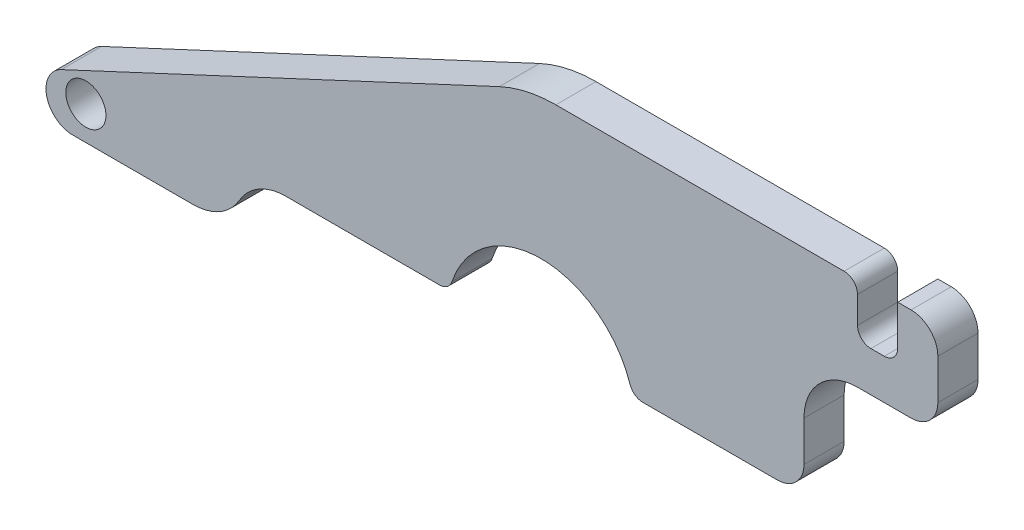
SolidWorks part; units mm, degrees
ref_plane "Front Plane" through (0, 0, 0) normal (0, 0, 1) x (1, 0, 0)
ref_plane "Top Plane" through (0, 0, 0) normal (0, 1, 0) x (1, 0, 0)
ref_plane "Right Plane" through (0, 0, 0) normal (1, 0, 0) x (0, 0, -1)
sketch "Sketch1" plane through (0, 0, 0) normal (0, 0, 1) x (1, 0, 0)
  line L0 (-25.9119, 5.4688) -> (-9.5595, 13.094)
  line L1 (-7.4465, 13.5625) -> (3.3201, 13.5625)
  line L2 (3.8201, 13.0625) -> (3.8201, 12.0625)
  line L3 (4.3201, 11.5625) -> (4.8201, 11.5625)
  line L4 (5.3201, 12.0625) -> (5.3201, 13.5625)
  line L5 (5.3201, 13.5625) -> (5.8201, 13.5625)
  line L6 (6.8201, 12.5625) -> (6.8201, 11.0625)
  line L7 (5.8201, 10.0625) -> (4.0076, 10.0625)
  line L8 (4.0076, 10.0625) -> (3.8201, 10.0625)
  line L9 (1.8201, 8.0625) -> (1.8201, 6.5625)
  line L10 (0.8201, 5.5625) -> (-4.2003, 5.5625)
  line L12 (-25.4893, 3.5625) -> (-21, 3.5625)
  line L13 (-30.1051, 5.5625) -> (3.2401, 5.5625) construction
  line L14 (-11.7997, 5.5625) -> (-17.5359, 5.5625)
  arc A0 (-11.3247, 5.9063) -> (-4.6753, 5.9063) centre (-8, 4.8125) cw
  circle A1 centre (-25, 4.8125) radius 0.75
  arc A2 (1.8201, 6.5625) -> (0.8201, 5.5625) centre (0.8201, 6.5625) cw
  arc A3 (6.8201, 11.0625) -> (5.8201, 10.0625) centre (5.8201, 11.0625) cw
  arc A4 (5.8201, 13.5625) -> (6.8201, 12.5625) centre (5.8201, 12.5625) cw
  arc A5 (-25.9119, 5.4688) -> (-25.4893, 3.5625) centre (-25.4893, 4.5625) ccw
  arc A8 (3.3201, 13.5625) -> (3.8201, 13.0625) centre (3.3201, 13.0625) cw
  arc A9 (4.8201, 11.5625) -> (5.3201, 12.0625) centre (4.8201, 12.0625) ccw
  arc A10 (3.8201, 12.0625) -> (4.3201, 11.5625) centre (4.3201, 12.0625) ccw
  arc A11 (-9.5595, 13.094) -> (-7.4465, 13.5625) centre (-7.4465, 8.5625) cw
  arc A12 (3.8201, 10.0625) -> (1.8201, 8.0625) centre (3.8201, 8.0625) ccw
  arc A13 (-21, 3.5625) -> (-19.2679, 4.5625) centre (-21, 5.5625) ccw
  arc A14 (-17.5359, 5.5625) -> (-19.2679, 4.5625) centre (-17.5359, 3.5625) ccw
  arc A15 (-4.2003, 5.5625) -> (-4.6753, 5.9063) centre (-4.2003, 6.0625) cw
  arc A16 (-11.3247, 5.9063) -> (-11.7997, 5.5625) centre (-11.7997, 6.0625) cw
  point P12 (0, 0)
  point P20 (6.8201, 10.0625)
  point P23 (6.8201, 13.5625)
  point P26 (-30, 3.5625)
  point P29 (-4.7308, 3.5625)
  point P36 (5.3201, 11.5625)
  point P41 (-8.5549, 13.5625)
  dimension "D6" = 3.5
  dimension "D9" = 5
  dimension "D7" = 1
  dimension "D14" = 1.5
  dimension "D15" = 5
  dimension "D16" = 2
  dimension "D17" = 4
  dimension "D18" = 0.5
  dimension "D1" = 1.5
  dimension "D2" = 3.5
  dimension "D3" = 15.375
  dimension "D4" = 1.5
  dimension "D5" = 2
  dimension "D8" = 10
  dimension "D10" = 1.25
  dimension "D11" = 5
  dimension "D12" = 17
  dimension "D13" = 25
extrude "Boss-Extrude1" add sketch "Sketch1" along normal blind 1.5
